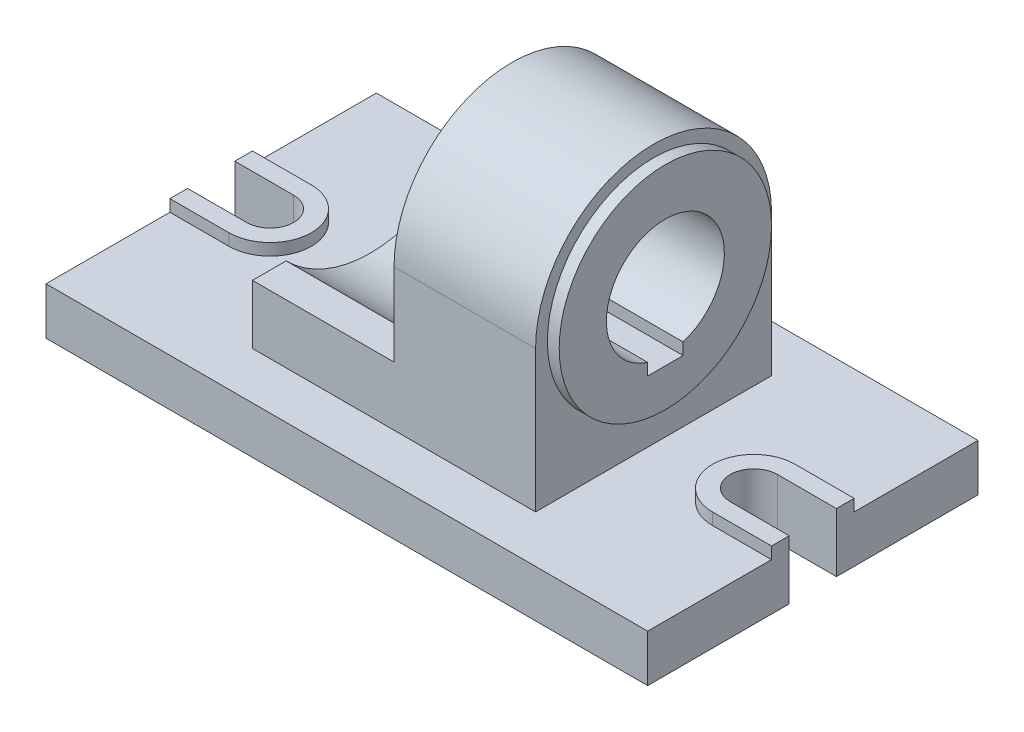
SolidWorks part; units mm, degrees
ref_plane "前视基准面" through (0, 0, 0) normal (0, 0, 1) x (1, 0, 0)
ref_plane "上视基准面" through (0, 0, 0) normal (0, 1, 0) x (1, 0, 0)
ref_plane "右视基准面" through (0, 0, 0) normal (1, 0, 0) x (0, 0, -1)
sketch "草图1" plane through (0, 0, 0) normal (0, 1, 0) x (1, 0, 0)
  line L0 (0, 0) -> (81.0902, 0) construction
  line L1 (0, 0) -> (0, 71.4557) construction
  line L2 (41, 4) -> (51, 4)
  line L3 (-51, 28) -> (51, 28)
  line L4 (-51, 28) -> (-51, 4)
  line L5 (-51, -28) -> (51, -28)
  line L6 (51, 28) -> (51, 4)
  line L7 (-51, -4) -> (-41, -4)
  line L8 (51, -4) -> (41, -4)
  line L9 (51, -4) -> (51, -28)
  line L10 (-41, 4) -> (-51, 4)
  line L11 (-51, -4) -> (-51, -28)
  arc A0 (41, 4) -> (41, -4) centre (41, 0) ccw
  arc A1 (-41, 4) -> (-41, -4) centre (-41, 0) cw
  dimension "D1" = 10
extrude "拉伸1" add sketch "草图1" along normal blind 8
sketch "草图2" plane through (0, 8, 0) normal (0, 1, 0) x (1, 0, 0)
  line L0 (41, 7) -> (51, 7)
  line L1 (51, 4) -> (51, 28) construction
  line L2 (51, 7) -> (51, 4)
  line L3 (51, 4) -> (46.7446, 4)
  line L4 (41, -7) -> (51, -7)
  line L5 (51, -28) -> (51, -4) construction
  line L6 (51, -7) -> (51, -4)
  line L7 (51, -4) -> (41, -4)
  line L8 (46.7446, 4) -> (41, 4)
  line L9 (0, 0) -> (0, 36.5426) construction
  line L10 (-46.7446, 4) -> (-41, 4)
  line L11 (-51, -4) -> (-41, -4)
  line L12 (-51, -7) -> (-51, -4)
  line L13 (-41, -7) -> (-51, -7)
  line L14 (-51, 4) -> (-46.7446, 4)
  line L15 (-51, 7) -> (-51, 4)
  line L16 (-41, 7) -> (-51, 7)
  arc A0 (41, 7) -> (41, -7) centre (41, 0) ccw
  arc A1 (41, 4) -> (41, -4) centre (41, 0) ccw
  arc A2 (-41, 4) -> (-41, -4) centre (-41, 0) cw
  arc A3 (-41, 7) -> (-41, -7) centre (-41, 0) cw
extrude "拉伸2" add sketch "草图2" along normal blind 2
sketch "草图3" plane through (0, 0, 0) normal (1, 0, 0) x (0, 0, -1)
  line L0 (-3, 22.4606) -> (-3, 20.4606)
  line L1 (-3, 20.4606) -> (3, 20.4606)
  line L2 (3, 20.4606) -> (3, 22.4606)
  line L3 (0, 0) -> (0, 47.8126) construction
  line L4 (20, 32) -> (20, 8)
  line L5 (7, 8) -> (28, 8) construction
  line L6 (-20, 32) -> (-20, 8)
  line L7 (-28, 8) -> (-7, 8) construction
  line L8 (-20, 8) -> (20, 8)
  arc A0 (20, 32) -> (-20, 32) centre (0, 32) ccw
  arc A1 (3, 22.4606) -> (-3, 22.4606) centre (0, 32) ccw
extrude "拉伸3" add sketch "草图3" along normal blind 24
sketch "草图4" plane through (0, 0, 0) normal (-1, 0, 0) x (0, 0, 1)
  line L0 (20, 8) -> (20, 18)
  line L1 (20, 32) -> (20, 8) construction
  line L2 (20, 18) -> (14.2829, 18)
  line L3 (0, 0) -> (0, 36.3133) construction
  line L4 (-20, 18) -> (-14.2829, 18)
  line L5 (-20, 8) -> (-20, 18)
  line L6 (20, 8) -> (-20, 8)
  arc A0 (-14.2829, 18) -> (14.2829, 18) centre (0, 32) ccw
extrude "拉伸4" add sketch "草图4" along normal blind 24
sketch "草图5" plane through (24, 0, 0) normal (1, 0, 0) x (0, 0, -1)
  line L0 (3, 22.4606) -> (3, 20.4606)
  line L1 (3, 20.4606) -> (-3, 20.4606)
  line L2 (-3, 20.4606) -> (-3, 22.4606)
  circle A0 centre (0, 32) radius 18
  arc A1 (3, 22.4606) -> (-3, 22.4606) centre (0, 32) ccw
extrude "拉伸5" add sketch "草图5" along normal blind 2
